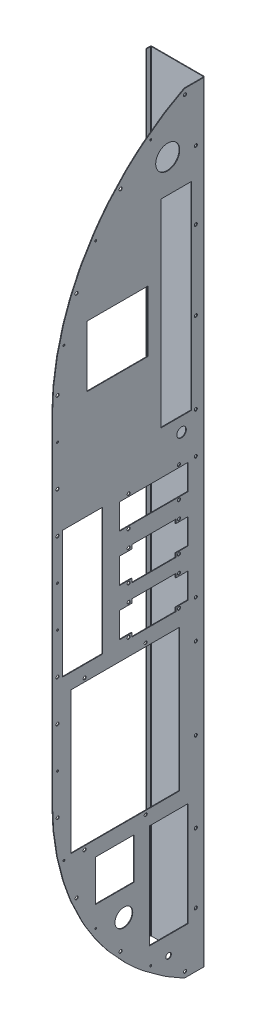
SolidWorks part; units mm, degrees
ref_plane "Front Plane" through (0, 0, 0) normal (0, 0, 1) x (1, 0, 0)
ref_plane "Top Plane" through (0, 0, 0) normal (0, 1, 0) x (1, 0, 0)
ref_plane "Right Plane" through (0, 0, 0) normal (1, 0, 0) x (0, 0, -1)
imported_body "Imported3"
sketch "Sketch1" plane through (0, 0, 767.8712) normal (0, 0, 1) x (1, 0, 0)
  line L0 (840.893, 1048.4829) -> (840.893, 86.5849)
  line L1 (840.893, 86.5849) -> (840.0993, 86.5849)
  line L2 (840.0993, 86.5849) -> (840.0993, 1048.4829)
  line L3 (840.0993, 1048.4829) -> (840.893, 1048.4829)
extrude "Boss-Extrude1" add sketch "Sketch1" along normal blind 4.7435
sketch "Sketch2" plane through (906.7425, 0, 0) normal (-1, 0, 0) x (0, 0, 1)
  line L0 (872.7296, 979.9071) -> (872.6759, 980.1076)
  line L1 (872.6759, 980.1076) -> (872.5882, 980.2957)
  line L2 (872.5882, 980.2957) -> (872.4691, 980.4657)
  line L3 (872.4691, 980.4657) -> (872.3224, 980.6124)
  line L4 (872.3224, 980.6124) -> (872.1523, 980.7315)
  line L5 (872.1523, 980.7315) -> (871.9643, 980.8192)
  line L6 (871.9643, 980.8192) -> (871.7638, 980.8729)
  line L7 (871.7638, 980.8729) -> (871.5571, 980.891)
  line L8 (871.5571, 980.891) -> (871.3503, 980.8729)
  line L9 (871.3503, 980.8729) -> (871.1498, 980.8192)
  line L10 (871.1498, 980.8192) -> (870.9617, 980.7315)
  line L11 (870.9617, 980.7315) -> (870.7917, 980.6124)
  line L12 (870.7917, 980.6124) -> (870.645, 980.4657)
  line L13 (870.645, 980.4657) -> (870.526, 980.2957)
  line L14 (870.526, 980.2957) -> (870.4382, 980.1076)
  line L15 (870.4382, 980.1076) -> (870.3845, 979.9071)
  line L16 (870.3845, 979.9071) -> (870.3665, 979.7004)
  line L17 (870.3665, 979.7004) -> (870.3845, 979.4937)
  line L18 (870.3845, 979.4937) -> (870.4382, 979.2932)
  line L19 (870.4382, 979.2932) -> (870.526, 979.1051)
  line L20 (870.526, 979.1051) -> (870.645, 978.9351)
  line L21 (870.645, 978.9351) -> (870.7917, 978.7883)
  line L22 (870.7917, 978.7883) -> (870.9617, 978.6693)
  line L23 (870.9617, 978.6693) -> (871.1498, 978.5816)
  line L24 (871.1498, 978.5816) -> (871.3503, 978.5278)
  line L25 (871.3503, 978.5278) -> (871.5571, 978.5098)
  line L26 (871.5571, 978.5098) -> (871.7638, 978.5278)
  line L27 (871.7638, 978.5278) -> (871.9643, 978.5816)
  line L28 (871.9643, 978.5816) -> (872.1523, 978.6693)
  line L29 (872.1523, 978.6693) -> (872.3224, 978.7883)
  line L30 (872.3224, 978.7883) -> (872.4691, 978.9351)
  line L31 (872.4691, 978.9351) -> (872.5882, 979.1051)
  line L32 (872.5882, 979.1051) -> (872.6759, 979.2932)
  line L33 (872.6759, 979.2932) -> (872.7296, 979.4937)
  line L34 (872.7296, 979.4937) -> (872.7477, 979.7004)
  line L35 (872.7477, 979.7004) -> (872.7296, 979.9071)
extrude "Cut-Extrude1" cut sketch "Sketch2" against normal through all
sketch "Sketch3" plane through (906.7425, 0, 0) normal (-1, 0, 0) x (0, 0, 1)
  line L0 (790.2309, 94.2395) -> (790.1118, 94.0695)
  line L1 (790.1118, 94.0695) -> (790.0241, 93.8814)
  line L2 (790.0241, 93.8814) -> (789.9704, 93.6809)
  line L3 (789.9704, 93.6809) -> (789.9523, 93.4741)
  line L4 (789.9523, 93.4741) -> (789.9704, 93.2674)
  line L5 (789.9704, 93.2674) -> (790.0241, 93.0669)
  line L6 (790.0241, 93.0669) -> (790.1118, 92.8788)
  line L7 (790.1118, 92.8788) -> (790.2309, 92.7089)
  line L8 (790.2309, 92.7089) -> (790.3776, 92.5621)
  line L9 (790.3776, 92.5621) -> (790.5476, 92.443)
  line L10 (790.5476, 92.443) -> (790.7357, 92.3553)
  line L11 (790.7357, 92.3553) -> (790.9362, 92.3016)
  line L12 (790.9362, 92.3016) -> (791.1429, 92.2835)
  line L13 (791.1429, 92.2835) -> (791.3496, 92.3016)
  line L14 (791.3496, 92.3016) -> (791.5502, 92.3553)
  line L15 (791.5502, 92.3553) -> (791.7383, 92.443)
  line L16 (791.7383, 92.443) -> (791.9083, 92.5621)
  line L17 (791.9083, 92.5621) -> (792.055, 92.7089)
  line L18 (792.055, 92.7089) -> (792.1741, 92.8788)
  line L19 (792.1741, 92.8788) -> (792.2618, 93.0669)
  line L20 (792.2618, 93.0669) -> (792.3155, 93.2674)
  line L21 (792.3155, 93.2674) -> (792.3335, 93.4741)
  line L22 (792.3335, 93.4741) -> (792.3155, 93.6809)
  line L23 (792.3155, 93.6809) -> (792.2618, 93.8814)
  line L24 (792.2618, 93.8814) -> (792.1741, 94.0695)
  line L25 (792.1741, 94.0695) -> (792.055, 94.2395)
  line L26 (792.055, 94.2395) -> (791.9083, 94.3862)
  line L27 (791.9083, 94.3862) -> (791.7383, 94.5053)
  line L28 (791.7383, 94.5053) -> (791.5502, 94.593)
  line L29 (791.5502, 94.593) -> (791.3496, 94.6467)
  line L30 (791.3496, 94.6467) -> (791.1429, 94.6648)
  line L31 (791.1429, 94.6648) -> (790.9362, 94.6467)
  line L32 (790.9362, 94.6467) -> (790.7357, 94.593)
  line L33 (790.7357, 94.593) -> (790.5476, 94.5053)
  line L34 (790.5476, 94.5053) -> (790.3776, 94.3862)
  line L35 (790.3776, 94.3862) -> (790.2309, 94.2395)
  circle A0 centre (791.143, 93.4742) radius 1.1906
extrude "Cut-Extrude2" cut sketch "Sketch3" against normal through all contours L35 L0 L1 L2 L3 L4 L5 L6 L7 L8 L9 L10 L11 L12 L13 L14 L15 L16 L17 L18 L19 L20 L21 L22 L23 L24 L25 L26 L27 L28 L29 L30 L31 L32 L33 L34
sketch "Sketch4" plane through (906.7425, 0, 0) normal (-1, 0, 0) x (0, 0, 1)
  line L0 (835.1724, 1014.2965) -> (835.1187, 1014.497)
  line L1 (835.1187, 1014.497) -> (835.0309, 1014.685)
  line L2 (835.0309, 1014.685) -> (834.9119, 1014.8551)
  line L3 (834.9119, 1014.8551) -> (834.7651, 1015.0018)
  line L4 (834.7651, 1015.0018) -> (834.5951, 1015.1209)
  line L5 (834.5951, 1015.1209) -> (834.407, 1015.2086)
  line L6 (834.407, 1015.2086) -> (834.2065, 1015.2622)
  line L7 (834.2065, 1015.2622) -> (833.9998, 1015.2804)
  line L8 (833.9998, 1015.2804) -> (833.793, 1015.2622)
  line L9 (833.793, 1015.2622) -> (833.5926, 1015.2086)
  line L10 (833.5926, 1015.2086) -> (833.4045, 1015.1209)
  line L11 (833.4045, 1015.1209) -> (833.2345, 1015.0018)
  line L12 (833.2345, 1015.0018) -> (833.0877, 1014.8551)
  line L13 (833.0877, 1014.8551) -> (832.9687, 1014.685)
  line L14 (832.9687, 1014.685) -> (832.881, 1014.497)
  line L15 (832.881, 1014.497) -> (832.8273, 1014.2965)
  line L16 (832.8273, 1014.2965) -> (832.8092, 1014.0898)
  line L17 (832.8092, 1014.0898) -> (832.8273, 1013.883)
  line L18 (832.8273, 1013.883) -> (832.881, 1013.6826)
  line L19 (832.881, 1013.6826) -> (832.9687, 1013.4945)
  line L20 (832.9687, 1013.4945) -> (833.0877, 1013.3245)
  line L21 (833.0877, 1013.3245) -> (833.2345, 1013.1776)
  line L22 (833.2345, 1013.1776) -> (833.4045, 1013.0587)
  line L23 (833.4045, 1013.0587) -> (833.5926, 1012.9709)
  line L24 (833.5926, 1012.9709) -> (833.793, 1012.9173)
  line L25 (833.793, 1012.9173) -> (833.9998, 1012.8992)
  line L26 (833.9998, 1012.8992) -> (834.2065, 1012.9173)
  line L27 (834.2065, 1012.9173) -> (834.407, 1012.9709)
  line L28 (834.407, 1012.9709) -> (834.5951, 1013.0587)
  line L29 (834.5951, 1013.0587) -> (834.7651, 1013.1776)
  line L30 (834.7651, 1013.1776) -> (834.9119, 1013.3245)
  line L31 (834.9119, 1013.3245) -> (835.0309, 1013.4945)
  line L32 (835.0309, 1013.4945) -> (835.1187, 1013.6826)
  line L33 (835.1187, 1013.6826) -> (835.1724, 1013.883)
  line L34 (835.1724, 1013.883) -> (835.1904, 1014.0898)
  line L35 (835.1904, 1014.0898) -> (835.1724, 1014.2965)
extrude "Cut-Extrude3" cut sketch "Sketch4" against normal through all
sketch "Sketch5" plane through (906.7425, 0, 0) normal (-1, 0, 0) x (0, 0, 1)
  line L0 (833.5926, 119.8592) -> (833.793, 119.8055)
  line L1 (833.793, 119.8055) -> (833.9998, 119.7875)
  line L2 (833.9998, 119.7875) -> (834.2065, 119.8055)
  line L3 (834.2065, 119.8055) -> (834.407, 119.8592)
  line L4 (834.407, 119.8592) -> (834.5951, 119.947)
  line L5 (834.5951, 119.947) -> (834.7651, 120.066)
  line L6 (834.7651, 120.066) -> (834.9119, 120.2127)
  line L7 (834.9119, 120.2127) -> (835.0309, 120.3828)
  line L8 (835.0309, 120.3828) -> (835.1187, 120.5708)
  line L9 (835.1187, 120.5708) -> (835.1724, 120.7713)
  line L10 (835.1724, 120.7713) -> (835.1904, 120.9781)
  line L11 (835.1904, 120.9781) -> (835.1724, 121.1848)
  line L12 (835.1724, 121.1848) -> (835.1187, 121.3853)
  line L13 (835.1187, 121.3853) -> (835.0309, 121.5734)
  line L14 (835.0309, 121.5734) -> (834.9119, 121.7434)
  line L15 (834.9119, 121.7434) -> (834.7651, 121.8901)
  line L16 (834.7651, 121.8901) -> (834.5951, 122.0092)
  line L17 (834.5951, 122.0092) -> (834.407, 122.0969)
  line L18 (834.407, 122.0969) -> (834.2065, 122.1506)
  line L19 (834.2065, 122.1506) -> (833.9998, 122.1687)
  line L20 (833.9998, 122.1687) -> (833.793, 122.1506)
  line L21 (833.793, 122.1506) -> (833.5926, 122.0969)
  line L22 (833.5926, 122.0969) -> (833.4045, 122.0092)
  line L23 (833.4045, 122.0092) -> (833.2345, 121.8901)
  line L24 (833.2345, 121.8901) -> (833.0877, 121.7434)
  line L25 (833.0877, 121.7434) -> (832.9687, 121.5734)
  line L26 (832.9687, 121.5734) -> (832.881, 121.3853)
  line L27 (832.881, 121.3853) -> (832.8273, 121.1848)
  line L28 (832.8273, 121.1848) -> (832.8092, 120.9781)
  line L29 (832.8092, 120.9781) -> (832.8273, 120.7713)
  line L30 (832.8273, 120.7713) -> (832.881, 120.5708)
  line L31 (832.881, 120.5708) -> (832.9687, 120.3828)
  line L32 (832.9687, 120.3828) -> (833.0877, 120.2127)
  line L33 (833.0877, 120.2127) -> (833.2345, 120.066)
  line L34 (833.2345, 120.066) -> (833.4045, 119.947)
  line L35 (833.4045, 119.947) -> (833.5926, 119.8592)
extrude "Cut-Extrude4" cut sketch "Sketch5" against normal through all
sketch "Sketch6" plane through (906.7425, 0, 0) normal (-1, 0, 0) x (0, 0, 1)
  line L0 (950.0074, 746.4527) -> (949.8193, 746.3651)
  line L1 (949.8193, 746.3651) -> (949.6493, 746.246)
  line L2 (949.6493, 746.246) -> (949.5026, 746.0992)
  line L3 (949.5026, 746.0992) -> (949.3836, 745.9292)
  line L4 (949.3836, 745.9292) -> (949.2958, 745.7411)
  line L5 (949.2958, 745.7411) -> (949.2421, 745.5407)
  line L6 (949.2421, 745.5407) -> (949.2241, 745.3339)
  line L7 (949.2241, 745.3339) -> (949.2421, 745.1271)
  line L8 (949.2421, 745.1271) -> (949.2958, 744.9267)
  line L9 (949.2958, 744.9267) -> (949.3836, 744.7386)
  line L10 (949.3836, 744.7386) -> (949.5026, 744.5686)
  line L11 (949.5026, 744.5686) -> (949.6493, 744.4218)
  line L12 (949.6493, 744.4218) -> (949.8193, 744.3028)
  line L13 (949.8193, 744.3028) -> (950.0074, 744.2151)
  line L14 (950.0074, 744.2151) -> (950.2079, 744.1614)
  line L15 (950.2079, 744.1614) -> (950.4147, 744.1433)
  line L16 (950.4147, 744.1433) -> (950.6214, 744.1614)
  line L17 (950.6214, 744.1614) -> (950.8219, 744.2151)
  line L18 (950.8219, 744.2151) -> (951.0099, 744.3028)
  line L19 (951.0099, 744.3028) -> (951.18, 744.4218)
  line L20 (951.18, 744.4218) -> (951.3267, 744.5686)
  line L21 (951.3267, 744.5686) -> (951.4458, 744.7386)
  line L22 (951.4458, 744.7386) -> (951.5335, 744.9267)
  line L23 (951.5335, 744.9267) -> (951.5872, 745.1271)
  line L24 (951.5872, 745.1271) -> (951.6053, 745.3339)
  line L25 (951.6053, 745.3339) -> (951.5872, 745.5407)
  line L26 (951.5872, 745.5407) -> (951.5335, 745.7411)
  line L27 (951.5335, 745.7411) -> (951.4458, 745.9292)
  line L28 (951.4458, 745.9292) -> (951.3267, 746.0992)
  line L29 (951.3267, 746.0992) -> (951.18, 746.246)
  line L30 (951.18, 746.246) -> (951.0099, 746.3651)
  line L31 (951.0099, 746.3651) -> (950.8219, 746.4527)
  line L32 (950.8219, 746.4527) -> (950.6214, 746.5065)
  line L33 (950.6214, 746.5065) -> (950.4147, 746.5245)
  line L34 (950.4147, 746.5245) -> (950.2079, 746.5065)
  line L35 (950.2079, 746.5065) -> (950.0074, 746.4527)
extrude "Cut-Extrude5" cut sketch "Sketch6" against normal through all
sketch "Sketch7" plane through (906.7425, 0, 0) normal (-1, 0, 0) x (0, 0, 1)
  line L0 (872.5882, 154.7721) -> (872.6759, 154.9602)
  line L1 (872.6759, 154.9602) -> (872.7296, 155.1607)
  line L2 (872.7296, 155.1607) -> (872.7477, 155.3674)
  line L3 (872.7477, 155.3674) -> (872.7296, 155.5742)
  line L4 (872.7296, 155.5742) -> (872.6759, 155.7747)
  line L5 (872.6759, 155.7747) -> (872.5882, 155.9627)
  line L6 (872.5882, 155.9627) -> (872.4691, 156.1328)
  line L7 (872.4691, 156.1328) -> (872.3224, 156.2795)
  line L8 (872.3224, 156.2795) -> (872.1523, 156.3985)
  line L9 (872.1523, 156.3985) -> (871.9643, 156.4862)
  line L10 (871.9643, 156.4862) -> (871.7638, 156.54)
  line L11 (871.7638, 156.54) -> (871.5571, 156.5581)
  line L12 (871.5571, 156.5581) -> (871.3503, 156.54)
  line L13 (871.3503, 156.54) -> (871.1498, 156.4862)
  line L14 (871.1498, 156.4862) -> (870.9617, 156.3985)
  line L15 (870.9617, 156.3985) -> (870.7917, 156.2795)
  line L16 (870.7917, 156.2795) -> (870.645, 156.1328)
  line L17 (870.645, 156.1328) -> (870.526, 155.9627)
  line L18 (870.526, 155.9627) -> (870.4382, 155.7747)
  line L19 (870.4382, 155.7747) -> (870.3845, 155.5742)
  line L20 (870.3845, 155.5742) -> (870.3665, 155.3674)
  line L21 (870.3665, 155.3674) -> (870.3845, 155.1607)
  line L22 (870.3845, 155.1607) -> (870.4382, 154.9602)
  line L23 (870.4382, 154.9602) -> (870.526, 154.7721)
  line L24 (870.526, 154.7721) -> (870.645, 154.6021)
  line L25 (870.645, 154.6021) -> (870.7917, 154.4554)
  line L26 (870.7917, 154.4554) -> (870.9617, 154.3363)
  line L27 (870.9617, 154.3363) -> (871.1498, 154.2486)
  line L28 (871.1498, 154.2486) -> (871.3503, 154.1949)
  line L29 (871.3503, 154.1949) -> (871.5571, 154.1768)
  line L30 (871.5571, 154.1768) -> (871.7638, 154.1949)
  line L31 (871.7638, 154.1949) -> (871.9643, 154.2486)
  line L32 (871.9643, 154.2486) -> (872.1523, 154.3363)
  line L33 (872.1523, 154.3363) -> (872.3224, 154.4554)
  line L34 (872.3224, 154.4554) -> (872.4691, 154.6021)
  line L35 (872.4691, 154.6021) -> (872.5882, 154.7721)
extrude "Cut-Extrude6" cut sketch "Sketch7" against normal through all
sketch "Sketch8" plane through (906.7425, 0, 0) normal (-1, 0, 0) x (0, 0, 1)
  line L0 (927.7577, 894.6481) -> (927.704, 894.8485)
  line L1 (927.704, 894.8485) -> (927.6164, 895.0366)
  line L2 (927.6164, 895.0366) -> (927.4973, 895.2066)
  line L3 (927.4973, 895.2066) -> (927.3505, 895.3534)
  line L4 (927.3505, 895.3534) -> (927.1805, 895.4724)
  line L5 (927.1805, 895.4724) -> (926.9924, 895.5601)
  line L6 (926.9924, 895.5601) -> (926.792, 895.6138)
  line L7 (926.792, 895.6138) -> (926.5852, 895.632)
  line L8 (926.5852, 895.632) -> (926.3785, 895.6138)
  line L9 (926.3785, 895.6138) -> (926.178, 895.5601)
  line L10 (926.178, 895.5601) -> (925.9899, 895.4724)
  line L11 (925.9899, 895.4724) -> (925.8199, 895.3534)
  line L12 (925.8199, 895.3534) -> (925.6731, 895.2066)
  line L13 (925.6731, 895.2066) -> (925.5542, 895.0366)
  line L14 (925.5542, 895.0366) -> (925.4664, 894.8485)
  line L15 (925.4664, 894.8485) -> (925.4127, 894.6481)
  line L16 (925.4127, 894.6481) -> (925.3946, 894.4413)
  line L17 (925.3946, 894.4413) -> (925.4127, 894.2345)
  line L18 (925.4127, 894.2345) -> (925.4664, 894.034)
  line L19 (925.4664, 894.034) -> (925.5542, 893.846)
  line L20 (925.5542, 893.846) -> (925.6731, 893.676)
  line L21 (925.6731, 893.676) -> (925.8199, 893.5292)
  line L22 (925.8199, 893.5292) -> (925.9899, 893.4102)
  line L23 (925.9899, 893.4102) -> (926.178, 893.3225)
  line L24 (926.178, 893.3225) -> (926.3785, 893.2688)
  line L25 (926.3785, 893.2688) -> (926.5852, 893.2507)
  line L26 (926.5852, 893.2507) -> (926.792, 893.2688)
  line L27 (926.792, 893.2688) -> (926.9924, 893.3225)
  line L28 (926.9924, 893.3225) -> (927.1805, 893.4102)
  line L29 (927.1805, 893.4102) -> (927.3505, 893.5292)
  line L30 (927.3505, 893.5292) -> (927.4973, 893.676)
  line L31 (927.4973, 893.676) -> (927.6164, 893.846)
  line L32 (927.6164, 893.846) -> (927.704, 894.034)
  line L33 (927.704, 894.034) -> (927.7577, 894.2345)
  line L34 (927.7577, 894.2345) -> (927.7758, 894.4413)
  line L35 (927.7758, 894.4413) -> (927.7577, 894.6481)
extrude "Cut-Extrude7" cut sketch "Sketch8" against normal through all
sketch "Sketch9" plane through (906.7425, 0, 0) normal (-1, 0, 0) x (0, 0, 1)
  line L0 (903.7524, 938.8314) -> (903.8401, 939.0196)
  line L1 (903.8401, 939.0196) -> (903.8938, 939.22)
  line L2 (903.8938, 939.22) -> (903.9119, 939.4268)
  line L3 (903.9119, 939.4268) -> (903.8938, 939.6335)
  line L4 (903.8938, 939.6335) -> (903.8401, 939.834)
  line L5 (903.8401, 939.834) -> (903.7524, 940.0221)
  line L6 (903.7524, 940.0221) -> (903.6334, 940.1921)
  line L7 (903.6334, 940.1921) -> (903.4866, 940.3388)
  line L8 (903.4866, 940.3388) -> (903.3166, 940.4578)
  line L9 (903.3166, 940.4578) -> (903.1285, 940.5456)
  line L10 (903.1285, 940.5456) -> (902.9281, 940.5993)
  line L11 (902.9281, 940.5993) -> (902.7213, 940.6174)
  line L12 (902.7213, 940.6174) -> (902.5145, 940.5993)
  line L13 (902.5145, 940.5993) -> (902.3141, 940.5456)
  line L14 (902.3141, 940.5456) -> (902.126, 940.4578)
  line L15 (902.126, 940.4578) -> (901.956, 940.3388)
  line L16 (901.956, 940.3388) -> (901.8092, 940.1921)
  line L17 (901.8092, 940.1921) -> (901.6902, 940.0221)
  line L18 (901.6902, 940.0221) -> (901.6025, 939.834)
  line L19 (901.6025, 939.834) -> (901.5487, 939.6335)
  line L20 (901.5487, 939.6335) -> (901.5306, 939.4268)
  line L21 (901.5306, 939.4268) -> (901.5487, 939.22)
  line L22 (901.5487, 939.22) -> (901.6025, 939.0196)
  line L23 (901.6025, 939.0196) -> (901.6902, 938.8314)
  line L24 (901.6902, 938.8314) -> (901.8092, 938.6615)
  line L25 (901.8092, 938.6615) -> (901.956, 938.5147)
  line L26 (901.956, 938.5147) -> (902.126, 938.3956)
  line L27 (902.126, 938.3956) -> (902.3141, 938.3079)
  line L28 (902.3141, 938.3079) -> (902.5145, 938.2542)
  line L29 (902.5145, 938.2542) -> (902.7213, 938.2361)
  line L30 (902.7213, 938.2361) -> (902.9281, 938.2542)
  line L31 (902.9281, 938.2542) -> (903.1285, 938.3079)
  line L32 (903.1285, 938.3079) -> (903.3166, 938.3956)
  line L33 (903.3166, 938.3956) -> (903.4866, 938.5147)
  line L34 (903.4866, 938.5147) -> (903.6334, 938.6615)
  line L35 (903.6334, 938.6615) -> (903.7524, 938.8314)
extrude "Cut-Extrude8" cut sketch "Sketch9" against normal through all
sketch "Sketch10" plane through (906.7425, 0, 0) normal (-1, 0, 0) x (0, 0, 1)
  line L0 (950.0074, 492.4527) -> (949.8193, 492.365)
  line L1 (949.8193, 492.365) -> (949.6493, 492.246)
  line L2 (949.6493, 492.246) -> (949.5026, 492.0993)
  line L3 (949.5026, 492.0993) -> (949.3836, 491.9292)
  line L4 (949.3836, 491.9292) -> (949.2958, 491.7411)
  line L5 (949.2958, 491.7411) -> (949.2421, 491.5406)
  line L6 (949.2421, 491.5406) -> (949.2241, 491.3339)
  line L7 (949.2241, 491.3339) -> (949.2421, 491.1272)
  line L8 (949.2421, 491.1272) -> (949.2958, 490.9267)
  line L9 (949.2958, 490.9267) -> (949.3836, 490.7386)
  line L10 (949.3836, 490.7386) -> (949.5026, 490.5686)
  line L11 (949.5026, 490.5686) -> (949.6493, 490.4218)
  line L12 (949.6493, 490.4218) -> (949.8193, 490.3028)
  line L13 (949.8193, 490.3028) -> (950.0074, 490.2151)
  line L14 (950.0074, 490.2151) -> (950.2079, 490.1614)
  line L15 (950.2079, 490.1614) -> (950.4147, 490.1433)
  line L16 (950.4147, 490.1433) -> (950.6214, 490.1614)
  line L17 (950.6214, 490.1614) -> (950.8219, 490.2151)
  line L18 (950.8219, 490.2151) -> (951.0099, 490.3028)
  line L19 (951.0099, 490.3028) -> (951.18, 490.4218)
  line L20 (951.18, 490.4218) -> (951.3267, 490.5686)
  line L21 (951.3267, 490.5686) -> (951.4458, 490.7386)
  line L22 (951.4458, 490.7386) -> (951.5335, 490.9267)
  line L23 (951.5335, 490.9267) -> (951.5872, 491.1272)
  line L24 (951.5872, 491.1272) -> (951.6053, 491.3339)
  line L25 (951.6053, 491.3339) -> (951.5872, 491.5406)
  line L26 (951.5872, 491.5406) -> (951.5335, 491.7411)
  line L27 (951.5335, 491.7411) -> (951.4458, 491.9292)
  line L28 (951.4458, 491.9292) -> (951.3267, 492.0993)
  line L29 (951.3267, 492.0993) -> (951.18, 492.246)
  line L30 (951.18, 492.246) -> (951.0099, 492.365)
  line L31 (951.0099, 492.365) -> (950.8219, 492.4527)
  line L32 (950.8219, 492.4527) -> (950.6214, 492.5064)
  line L33 (950.6214, 492.5064) -> (950.4147, 492.5245)
  line L34 (950.4147, 492.5245) -> (950.2079, 492.5064)
  line L35 (950.2079, 492.5064) -> (950.0074, 492.4527)
extrude "Cut-Extrude9" cut sketch "Sketch10" against normal through all
sketch "Sketch11" plane through (906.7425, 0, 0) normal (-1, 0, 0) x (0, 0, 1)
  line L0 (790.3776, 1042.5057) -> (790.2309, 1042.359)
  line L1 (790.2309, 1042.359) -> (790.1118, 1042.189)
  line L2 (790.1118, 1042.189) -> (790.0241, 1042.0009)
  line L3 (790.0241, 1042.0009) -> (789.9704, 1041.8004)
  line L4 (789.9704, 1041.8004) -> (789.9523, 1041.5937)
  line L5 (789.9523, 1041.5937) -> (789.9704, 1041.387)
  line L6 (789.9704, 1041.387) -> (790.0241, 1041.1865)
  line L7 (790.0241, 1041.1865) -> (790.1118, 1040.9983)
  line L8 (790.1118, 1040.9983) -> (790.2309, 1040.8283)
  line L9 (790.2309, 1040.8283) -> (790.3776, 1040.6816)
  line L10 (790.3776, 1040.6816) -> (790.5476, 1040.5625)
  line L11 (790.5476, 1040.5625) -> (790.7357, 1040.4749)
  line L12 (790.7357, 1040.4749) -> (790.9362, 1040.4211)
  line L13 (790.9362, 1040.4211) -> (791.1429, 1040.4031)
  line L14 (791.1429, 1040.4031) -> (791.3496, 1040.4211)
  line L15 (791.3496, 1040.4211) -> (791.5502, 1040.4749)
  line L16 (791.5502, 1040.4749) -> (791.7383, 1040.5625)
  line L17 (791.7383, 1040.5625) -> (791.9083, 1040.6816)
  line L18 (791.9083, 1040.6816) -> (792.055, 1040.8283)
  line L19 (792.055, 1040.8283) -> (792.1741, 1040.9983)
  line L20 (792.1741, 1040.9983) -> (792.2618, 1041.1865)
  line L21 (792.2618, 1041.1865) -> (792.3155, 1041.387)
  line L22 (792.3155, 1041.387) -> (792.3335, 1041.5937)
  line L23 (792.3335, 1041.5937) -> (792.3155, 1041.8004)
  line L24 (792.3155, 1041.8004) -> (792.2618, 1042.0009)
  line L25 (792.2618, 1042.0009) -> (792.1741, 1042.189)
  line L26 (792.1741, 1042.189) -> (792.055, 1042.359)
  line L27 (792.055, 1042.359) -> (791.9083, 1042.5057)
  line L28 (791.9083, 1042.5057) -> (791.7383, 1042.6247)
  line L29 (791.7383, 1042.6247) -> (791.5502, 1042.7126)
  line L30 (791.5502, 1042.7126) -> (791.3496, 1042.7662)
  line L31 (791.3496, 1042.7662) -> (791.1429, 1042.7843)
  line L32 (791.1429, 1042.7843) -> (790.9362, 1042.7662)
  line L33 (790.9362, 1042.7662) -> (790.7357, 1042.7126)
  line L34 (790.7357, 1042.7126) -> (790.5476, 1042.6247)
  line L35 (790.5476, 1042.6247) -> (790.3776, 1042.5057)
extrude "Cut-Extrude10" cut sketch "Sketch11" against normal through all
sketch "Sketch12" plane through (906.7425, 0, 0) normal (-1, 0, 0) x (0, 0, 1)
  line L0 (950.1864, 797.0831) -> (949.9797, 797.065)
  line L1 (949.9797, 797.065) -> (949.7792, 797.0113)
  line L2 (949.7792, 797.0113) -> (949.5911, 796.9236)
  line L3 (949.5911, 796.9236) -> (949.4211, 796.8045)
  line L4 (949.4211, 796.8045) -> (949.2744, 796.6578)
  line L5 (949.2744, 796.6578) -> (949.1553, 796.4878)
  line L6 (949.1553, 796.4878) -> (949.0677, 796.2997)
  line L7 (949.0677, 796.2997) -> (949.0139, 796.0992)
  line L8 (949.0139, 796.0992) -> (948.9958, 795.8925)
  line L9 (948.9958, 795.8925) -> (949.0139, 795.6857)
  line L10 (949.0139, 795.6857) -> (949.0677, 795.4853)
  line L11 (949.0677, 795.4853) -> (949.1553, 795.2971)
  line L12 (949.1553, 795.2971) -> (949.2744, 795.1272)
  line L13 (949.2744, 795.1272) -> (949.4211, 794.9804)
  line L14 (949.4211, 794.9804) -> (949.5911, 794.8613)
  line L15 (949.5911, 794.8613) -> (949.7792, 794.7736)
  line L16 (949.7792, 794.7736) -> (949.9797, 794.7199)
  line L17 (949.9797, 794.7199) -> (950.1864, 794.7018)
  line L18 (950.1864, 794.7018) -> (950.3932, 794.7199)
  line L19 (950.3932, 794.7199) -> (950.5937, 794.7736)
  line L20 (950.5937, 794.7736) -> (950.7818, 794.8613)
  line L21 (950.7818, 794.8613) -> (950.9518, 794.9804)
  line L22 (950.9518, 794.9804) -> (951.0985, 795.1272)
  line L23 (951.0985, 795.1272) -> (951.2175, 795.2971)
  line L24 (951.2175, 795.2971) -> (951.3052, 795.4853)
  line L25 (951.3052, 795.4853) -> (951.359, 795.6857)
  line L26 (951.359, 795.6857) -> (951.3771, 795.8925)
  line L27 (951.3771, 795.8925) -> (951.359, 796.0992)
  line L28 (951.359, 796.0992) -> (951.3052, 796.2997)
  line L29 (951.3052, 796.2997) -> (951.2175, 796.4878)
  line L30 (951.2175, 796.4878) -> (951.0985, 796.6578)
  line L31 (951.0985, 796.6578) -> (950.9518, 796.8045)
  line L32 (950.9518, 796.8045) -> (950.7818, 796.9236)
  line L33 (950.7818, 796.9236) -> (950.5937, 797.0113)
  line L34 (950.5937, 797.0113) -> (950.3932, 797.065)
  line L35 (950.3932, 797.065) -> (950.1864, 797.0831)
extrude "Cut-Extrude11" cut sketch "Sketch12" against normal through all
sketch "Sketch13" plane through (906.7425, 0, 0) normal (-1, 0, 0) x (0, 0, 1)
  line L0 (943.5901, 846.4452) -> (943.5024, 846.6333)
  line L1 (943.5024, 846.6333) -> (943.3833, 846.8033)
  line L2 (943.3833, 846.8033) -> (943.2366, 846.95)
  line L3 (943.2366, 846.95) -> (943.0666, 847.0691)
  line L4 (943.0666, 847.0691) -> (942.8785, 847.1568)
  line L5 (942.8785, 847.1568) -> (942.678, 847.2105)
  line L6 (942.678, 847.2105) -> (942.4713, 847.2286)
  line L7 (942.4713, 847.2286) -> (942.2645, 847.2105)
  line L8 (942.2645, 847.2105) -> (942.064, 847.1568)
  line L9 (942.064, 847.1568) -> (941.876, 847.0691)
  line L10 (941.876, 847.0691) -> (941.7059, 846.95)
  line L11 (941.7059, 846.95) -> (941.5592, 846.8033)
  line L12 (941.5592, 846.8033) -> (941.4401, 846.6333)
  line L13 (941.4401, 846.6333) -> (941.3524, 846.4452)
  line L14 (941.3524, 846.4452) -> (941.2988, 846.2448)
  line L15 (941.2988, 846.2448) -> (941.2807, 846.038)
  line L16 (941.2807, 846.038) -> (941.2988, 845.8312)
  line L17 (941.2988, 845.8312) -> (941.3524, 845.6308)
  line L18 (941.3524, 845.6308) -> (941.4401, 845.4427)
  line L19 (941.4401, 845.4427) -> (941.5592, 845.2727)
  line L20 (941.5592, 845.2727) -> (941.7059, 845.1259)
  line L21 (941.7059, 845.1259) -> (941.876, 845.0068)
  line L22 (941.876, 845.0068) -> (942.064, 844.9191)
  line L23 (942.064, 844.9191) -> (942.2645, 844.8654)
  line L24 (942.2645, 844.8654) -> (942.4713, 844.8473)
  line L25 (942.4713, 844.8473) -> (942.678, 844.8654)
  line L26 (942.678, 844.8654) -> (942.8785, 844.9191)
  line L27 (942.8785, 844.9191) -> (943.0666, 845.0068)
  line L28 (943.0666, 845.0068) -> (943.2366, 845.1259)
  line L29 (943.2366, 845.1259) -> (943.3833, 845.2727)
  line L30 (943.3833, 845.2727) -> (943.5024, 845.4427)
  line L31 (943.5024, 845.4427) -> (943.5901, 845.6308)
  line L32 (943.5901, 845.6308) -> (943.6438, 845.8312)
  line L33 (943.6438, 845.8312) -> (943.6619, 846.038)
  line L34 (943.6619, 846.038) -> (943.6438, 846.2448)
  line L35 (943.6438, 846.2448) -> (943.5901, 846.4452)
extrude "Cut-Extrude12" cut sketch "Sketch13" against normal through all
sketch "Sketch14" plane through (906.7425, 0, 0) normal (-1, 0, 0) x (0, 0, 1)
  line L0 (950.0074, 644.8527) -> (949.8193, 644.765)
  line L1 (949.8193, 644.765) -> (949.6493, 644.646)
  line L2 (949.6493, 644.646) -> (949.5026, 644.4992)
  line L3 (949.5026, 644.4992) -> (949.3836, 644.3292)
  line L4 (949.3836, 644.3292) -> (949.2958, 644.1411)
  line L5 (949.2958, 644.1411) -> (949.2421, 643.9407)
  line L6 (949.2421, 643.9407) -> (949.2241, 643.7339)
  line L7 (949.2241, 643.7339) -> (949.2421, 643.5272)
  line L8 (949.2421, 643.5272) -> (949.2958, 643.3267)
  line L9 (949.2958, 643.3267) -> (949.3836, 643.1386)
  line L10 (949.3836, 643.1386) -> (949.5026, 642.9686)
  line L11 (949.5026, 642.9686) -> (949.6493, 642.8218)
  line L12 (949.6493, 642.8218) -> (949.8193, 642.7028)
  line L13 (949.8193, 642.7028) -> (950.0074, 642.6151)
  line L14 (950.0074, 642.6151) -> (950.2079, 642.5614)
  line L15 (950.2079, 642.5614) -> (950.4147, 642.5433)
  line L16 (950.4147, 642.5433) -> (950.6214, 642.5614)
  line L17 (950.6214, 642.5614) -> (950.8219, 642.6151)
  line L18 (950.8219, 642.6151) -> (951.0099, 642.7028)
  line L19 (951.0099, 642.7028) -> (951.18, 642.8218)
  line L20 (951.18, 642.8218) -> (951.3267, 642.9686)
  line L21 (951.3267, 642.9686) -> (951.4458, 643.1386)
  line L22 (951.4458, 643.1386) -> (951.5335, 643.3267)
  line L23 (951.5335, 643.3267) -> (951.5872, 643.5272)
  line L24 (951.5872, 643.5272) -> (951.6053, 643.7339)
  line L25 (951.6053, 643.7339) -> (951.5872, 643.9407)
  line L26 (951.5872, 643.9407) -> (951.5335, 644.1411)
  line L27 (951.5335, 644.1411) -> (951.4458, 644.3292)
  line L28 (951.4458, 644.3292) -> (951.3267, 644.4992)
  line L29 (951.3267, 644.4992) -> (951.18, 644.646)
  line L30 (951.18, 644.646) -> (951.0099, 644.765)
  line L31 (951.0099, 644.765) -> (950.8219, 644.8527)
  line L32 (950.8219, 644.8527) -> (950.6214, 644.9065)
  line L33 (950.6214, 644.9065) -> (950.4147, 644.9246)
  line L34 (950.4147, 644.9246) -> (950.2079, 644.9065)
  line L35 (950.2079, 644.9065) -> (950.0074, 644.8527)
extrude "Cut-Extrude13" cut sketch "Sketch14" against normal through all
sketch "Sketch15" plane through (906.7425, 0, 0) normal (-1, 0, 0) x (0, 0, 1)
  line L0 (951.5335, 593.3411) -> (951.4458, 593.5292)
  line L1 (951.4458, 593.5292) -> (951.3267, 593.6992)
  line L2 (951.3267, 593.6992) -> (951.18, 593.846)
  line L3 (951.18, 593.846) -> (951.0099, 593.9651)
  line L4 (951.0099, 593.9651) -> (950.8219, 594.0527)
  line L5 (950.8219, 594.0527) -> (950.6214, 594.1064)
  line L6 (950.6214, 594.1064) -> (950.4147, 594.1245)
  line L7 (950.4147, 594.1245) -> (950.2079, 594.1064)
  line L8 (950.2079, 594.1064) -> (950.0074, 594.0527)
  line L9 (950.0074, 594.0527) -> (949.8193, 593.9651)
  line L10 (949.8193, 593.9651) -> (949.6493, 593.846)
  line L11 (949.6493, 593.846) -> (949.5026, 593.6992)
  line L12 (949.5026, 593.6992) -> (949.3836, 593.5292)
  line L13 (949.3836, 593.5292) -> (949.2958, 593.3411)
  line L14 (949.2958, 593.3411) -> (949.2421, 593.1407)
  line L15 (949.2421, 593.1407) -> (949.2241, 592.9339)
  line L16 (949.2241, 592.9339) -> (949.2421, 592.7272)
  line L17 (949.2421, 592.7272) -> (949.2958, 592.5267)
  line L18 (949.2958, 592.5267) -> (949.3836, 592.3386)
  line L19 (949.3836, 592.3386) -> (949.5026, 592.1686)
  line L20 (949.5026, 592.1686) -> (949.6493, 592.0218)
  line L21 (949.6493, 592.0218) -> (949.8193, 591.9028)
  line L22 (949.8193, 591.9028) -> (950.0074, 591.8151)
  line L23 (950.0074, 591.8151) -> (950.2079, 591.7614)
  line L24 (950.2079, 591.7614) -> (950.4147, 591.7433)
  line L25 (950.4147, 591.7433) -> (950.6214, 591.7614)
  line L26 (950.6214, 591.7614) -> (950.8219, 591.8151)
  line L27 (950.8219, 591.8151) -> (951.0099, 591.9028)
  line L28 (951.0099, 591.9028) -> (951.18, 592.0218)
  line L29 (951.18, 592.0218) -> (951.3267, 592.1686)
  line L30 (951.3267, 592.1686) -> (951.4458, 592.3386)
  line L31 (951.4458, 592.3386) -> (951.5335, 592.5267)
  line L32 (951.5335, 592.5267) -> (951.5872, 592.7272)
  line L33 (951.5872, 592.7272) -> (951.6053, 592.9339)
  line L34 (951.6053, 592.9339) -> (951.5872, 593.1407)
  line L35 (951.5872, 593.1407) -> (951.5335, 593.3411)
extrude "Cut-Extrude14" cut sketch "Sketch15" against normal through all
sketch "Sketch16" plane through (906.7425, 0, 0) normal (-1, 0, 0) x (0, 0, 1)
  line L0 (951.18, 693.6218) -> (951.3267, 693.7686)
  line L1 (951.3267, 693.7686) -> (951.4458, 693.9386)
  line L2 (951.4458, 693.9386) -> (951.5335, 694.1267)
  line L3 (951.5335, 694.1267) -> (951.5872, 694.3272)
  line L4 (951.5872, 694.3272) -> (951.6053, 694.5339)
  line L5 (951.6053, 694.5339) -> (951.5872, 694.7407)
  line L6 (951.5872, 694.7407) -> (951.5335, 694.9412)
  line L7 (951.5335, 694.9412) -> (951.4458, 695.1292)
  line L8 (951.4458, 695.1292) -> (951.3267, 695.2992)
  line L9 (951.3267, 695.2992) -> (951.18, 695.446)
  line L10 (951.18, 695.446) -> (951.0099, 695.565)
  line L11 (951.0099, 695.565) -> (950.8219, 695.6527)
  line L12 (950.8219, 695.6527) -> (950.6214, 695.7064)
  line L13 (950.6214, 695.7064) -> (950.4147, 695.7245)
  line L14 (950.4147, 695.7245) -> (950.2079, 695.7064)
  line L15 (950.2079, 695.7064) -> (950.0074, 695.6527)
  line L16 (950.0074, 695.6527) -> (949.8193, 695.565)
  line L17 (949.8193, 695.565) -> (949.6493, 695.446)
  line L18 (949.6493, 695.446) -> (949.5026, 695.2992)
  line L19 (949.5026, 695.2992) -> (949.3836, 695.1292)
  line L20 (949.3836, 695.1292) -> (949.2958, 694.9412)
  line L21 (949.2958, 694.9412) -> (949.2421, 694.7407)
  line L22 (949.2421, 694.7407) -> (949.2241, 694.5339)
  line L23 (949.2241, 694.5339) -> (949.2421, 694.3272)
  line L24 (949.2421, 694.3272) -> (949.2958, 694.1267)
  line L25 (949.2958, 694.1267) -> (949.3836, 693.9386)
  line L26 (949.3836, 693.9386) -> (949.5026, 693.7686)
  line L27 (949.5026, 693.7686) -> (949.6493, 693.6218)
  line L28 (949.6493, 693.6218) -> (949.8193, 693.5028)
  line L29 (949.8193, 693.5028) -> (950.0074, 693.4151)
  line L30 (950.0074, 693.4151) -> (950.2079, 693.3614)
  line L31 (950.2079, 693.3614) -> (950.4147, 693.3433)
  line L32 (950.4147, 693.3433) -> (950.6214, 693.3614)
  line L33 (950.6214, 693.3614) -> (950.8219, 693.4151)
  line L34 (950.8219, 693.4151) -> (951.0099, 693.5028)
  line L35 (951.0099, 693.5028) -> (951.18, 693.6218)
extrude "Cut-Extrude15" cut sketch "Sketch16" against normal through all
sketch "Sketch17" plane through (906.7425, 0, 0) normal (-1, 0, 0) x (0, 0, 1)
  line L0 (902.7213, 194.4504) -> (902.9281, 194.4685)
  line L1 (902.9281, 194.4685) -> (903.1285, 194.5223)
  line L2 (903.1285, 194.5223) -> (903.3166, 194.61)
  line L3 (903.3166, 194.61) -> (903.4866, 194.729)
  line L4 (903.4866, 194.729) -> (903.6334, 194.8757)
  line L5 (903.6334, 194.8757) -> (903.7524, 195.0458)
  line L6 (903.7524, 195.0458) -> (903.8401, 195.2339)
  line L7 (903.8401, 195.2339) -> (903.8938, 195.4343)
  line L8 (903.8938, 195.4343) -> (903.9119, 195.6411)
  line L9 (903.9119, 195.6411) -> (903.8938, 195.8478)
  line L10 (903.8938, 195.8478) -> (903.8401, 196.0483)
  line L11 (903.8401, 196.0483) -> (903.7524, 196.2364)
  line L12 (903.7524, 196.2364) -> (903.6334, 196.4064)
  line L13 (903.6334, 196.4064) -> (903.4866, 196.5531)
  line L14 (903.4866, 196.5531) -> (903.3166, 196.6722)
  line L15 (903.3166, 196.6722) -> (903.1285, 196.7599)
  line L16 (903.1285, 196.7599) -> (902.9281, 196.8136)
  line L17 (902.9281, 196.8136) -> (902.7213, 196.8317)
  line L18 (902.7213, 196.8317) -> (902.5145, 196.8136)
  line L19 (902.5145, 196.8136) -> (902.3141, 196.7599)
  line L20 (902.3141, 196.7599) -> (902.126, 196.6722)
  line L21 (902.126, 196.6722) -> (901.956, 196.5531)
  line L22 (901.956, 196.5531) -> (901.8092, 196.4064)
  line L23 (901.8092, 196.4064) -> (901.6902, 196.2364)
  line L24 (901.6902, 196.2364) -> (901.6025, 196.0483)
  line L25 (901.6025, 196.0483) -> (901.5487, 195.8478)
  line L26 (901.5487, 195.8478) -> (901.5306, 195.6411)
  line L27 (901.5306, 195.6411) -> (901.5487, 195.4343)
  line L28 (901.5487, 195.4343) -> (901.6025, 195.2339)
  line L29 (901.6025, 195.2339) -> (901.6902, 195.0458)
  line L30 (901.6902, 195.0458) -> (901.8092, 194.8757)
  line L31 (901.8092, 194.8757) -> (901.956, 194.729)
  line L32 (901.956, 194.729) -> (902.126, 194.61)
  line L33 (902.126, 194.61) -> (902.3141, 194.5223)
  line L34 (902.3141, 194.5223) -> (902.5145, 194.4685)
  line L35 (902.5145, 194.4685) -> (902.7213, 194.4504)
extrude "Cut-Extrude16" cut sketch "Sketch17" against normal through all
sketch "Sketch18" plane through (906.7425, 0, 0) normal (-1, 0, 0) x (0, 0, 1)
  line L0 (949.2958, 541.7267) -> (949.3836, 541.5386)
  line L1 (949.3836, 541.5386) -> (949.5026, 541.3686)
  line L2 (949.5026, 541.3686) -> (949.6493, 541.2219)
  line L3 (949.6493, 541.2219) -> (949.8193, 541.1028)
  line L4 (949.8193, 541.1028) -> (950.0074, 541.0151)
  line L5 (950.0074, 541.0151) -> (950.2079, 540.9614)
  line L6 (950.2079, 540.9614) -> (950.4147, 540.9433)
  line L7 (950.4147, 540.9433) -> (950.6214, 540.9614)
  line L8 (950.6214, 540.9614) -> (950.8219, 541.0151)
  line L9 (950.8219, 541.0151) -> (951.0099, 541.1028)
  line L10 (951.0099, 541.1028) -> (951.18, 541.2219)
  line L11 (951.18, 541.2219) -> (951.3267, 541.3686)
  line L12 (951.3267, 541.3686) -> (951.4458, 541.5386)
  line L13 (951.4458, 541.5386) -> (951.5335, 541.7267)
  line L14 (951.5335, 541.7267) -> (951.5872, 541.9272)
  line L15 (951.5872, 541.9272) -> (951.6053, 542.1339)
  line L16 (951.6053, 542.1339) -> (951.5872, 542.3406)
  line L17 (951.5872, 542.3406) -> (951.5335, 542.5411)
  line L18 (951.5335, 542.5411) -> (951.4458, 542.7293)
  line L19 (951.4458, 542.7293) -> (951.3267, 542.8993)
  line L20 (951.3267, 542.8993) -> (951.18, 543.0459)
  line L21 (951.18, 543.0459) -> (951.0099, 543.165)
  line L22 (951.0099, 543.165) -> (950.8219, 543.2528)
  line L23 (950.8219, 543.2528) -> (950.6214, 543.3065)
  line L24 (950.6214, 543.3065) -> (950.4147, 543.3245)
  line L25 (950.4147, 543.3245) -> (950.2079, 543.3065)
  line L26 (950.2079, 543.3065) -> (950.0074, 543.2528)
  line L27 (950.0074, 543.2528) -> (949.8193, 543.165)
  line L28 (949.8193, 543.165) -> (949.6493, 543.0459)
  line L29 (949.6493, 543.0459) -> (949.5026, 542.8993)
  line L30 (949.5026, 542.8993) -> (949.3836, 542.7293)
  line L31 (949.3836, 542.7293) -> (949.2958, 542.5411)
  line L32 (949.2958, 542.5411) -> (949.2421, 542.3406)
  line L33 (949.2421, 542.3406) -> (949.2241, 542.1339)
  line L34 (949.2241, 542.1339) -> (949.2421, 541.9272)
  line L35 (949.2421, 541.9272) -> (949.2958, 541.7267)
extrude "Cut-Extrude17" cut sketch "Sketch18" against normal through all
sketch "Sketch19" plane through (906.7425, 0, 0) normal (-1, 0, 0) x (0, 0, 1)
  line L0 (951.3267, 441.2992) -> (951.18, 441.446)
  line L1 (951.18, 441.446) -> (951.0099, 441.565)
  line L2 (951.0099, 441.565) -> (950.8219, 441.6527)
  line L3 (950.8219, 441.6527) -> (950.6214, 441.7064)
  line L4 (950.6214, 441.7064) -> (950.4147, 441.7245)
  line L5 (950.4147, 441.7245) -> (950.2079, 441.7064)
  line L6 (950.2079, 441.7064) -> (950.0074, 441.6527)
  line L7 (950.0074, 441.6527) -> (949.8193, 441.565)
  line L8 (949.8193, 441.565) -> (949.6493, 441.446)
  line L9 (949.6493, 441.446) -> (949.5026, 441.2992)
  line L10 (949.5026, 441.2992) -> (949.3836, 441.1292)
  line L11 (949.3836, 441.1292) -> (949.2958, 440.9411)
  line L12 (949.2958, 440.9411) -> (949.2421, 440.7407)
  line L13 (949.2421, 440.7407) -> (949.2241, 440.5339)
  line L14 (949.2241, 440.5339) -> (949.2421, 440.3271)
  line L15 (949.2421, 440.3271) -> (949.2958, 440.1267)
  line L16 (949.2958, 440.1267) -> (949.3836, 439.9386)
  line L17 (949.3836, 439.9386) -> (949.5026, 439.7686)
  line L18 (949.5026, 439.7686) -> (949.6493, 439.6218)
  line L19 (949.6493, 439.6218) -> (949.8193, 439.5028)
  line L20 (949.8193, 439.5028) -> (950.0074, 439.4151)
  line L21 (950.0074, 439.4151) -> (950.2079, 439.3614)
  line L22 (950.2079, 439.3614) -> (950.4147, 439.3433)
  line L23 (950.4147, 439.3433) -> (950.6214, 439.3614)
  line L24 (950.6214, 439.3614) -> (950.8219, 439.4151)
  line L25 (950.8219, 439.4151) -> (951.0099, 439.5028)
  line L26 (951.0099, 439.5028) -> (951.18, 439.6218)
  line L27 (951.18, 439.6218) -> (951.3267, 439.7686)
  line L28 (951.3267, 439.7686) -> (951.4458, 439.9386)
  line L29 (951.4458, 439.9386) -> (951.5335, 440.1267)
  line L30 (951.5335, 440.1267) -> (951.5872, 440.3271)
  line L31 (951.5872, 440.3271) -> (951.6053, 440.5339)
  line L32 (951.6053, 440.5339) -> (951.5872, 440.7407)
  line L33 (951.5872, 440.7407) -> (951.5335, 440.9411)
  line L34 (951.5335, 440.9411) -> (951.4458, 441.1292)
  line L35 (951.4458, 441.1292) -> (951.3267, 441.2992)
extrude "Cut-Extrude18" cut sketch "Sketch19" against normal through all
sketch "Sketch20" plane through (906.7425, 0, 0) normal (-1, 0, 0) x (0, 0, 1)
  line L0 (925.4664, 240.2193) -> (925.5542, 240.0312)
  line L1 (925.5542, 240.0312) -> (925.6731, 239.8612)
  line L2 (925.6731, 239.8612) -> (925.8199, 239.7144)
  line L3 (925.8199, 239.7144) -> (925.9899, 239.5954)
  line L4 (925.9899, 239.5954) -> (926.178, 239.5077)
  line L5 (926.178, 239.5077) -> (926.3785, 239.454)
  line L6 (926.3785, 239.454) -> (926.5852, 239.4359)
  line L7 (926.5852, 239.4359) -> (926.792, 239.454)
  line L8 (926.792, 239.454) -> (926.9924, 239.5077)
  line L9 (926.9924, 239.5077) -> (927.1805, 239.5954)
  line L10 (927.1805, 239.5954) -> (927.3505, 239.7144)
  line L11 (927.3505, 239.7144) -> (927.4973, 239.8612)
  line L12 (927.4973, 239.8612) -> (927.6164, 240.0312)
  line L13 (927.6164, 240.0312) -> (927.704, 240.2193)
  line L14 (927.704, 240.2193) -> (927.7577, 240.4197)
  line L15 (927.7577, 240.4197) -> (927.7758, 240.6265)
  line L16 (927.7758, 240.6265) -> (927.7577, 240.8333)
  line L17 (927.7577, 240.8333) -> (927.704, 241.0337)
  line L18 (927.704, 241.0337) -> (927.6164, 241.2218)
  line L19 (927.6164, 241.2218) -> (927.4973, 241.3918)
  line L20 (927.4973, 241.3918) -> (927.3505, 241.5386)
  line L21 (927.3505, 241.5386) -> (927.1805, 241.6576)
  line L22 (927.1805, 241.6576) -> (926.9924, 241.7453)
  line L23 (926.9924, 241.7453) -> (926.792, 241.799)
  line L24 (926.792, 241.799) -> (926.5852, 241.8171)
  line L25 (926.5852, 241.8171) -> (926.3785, 241.799)
  line L26 (926.3785, 241.799) -> (926.178, 241.7453)
  line L27 (926.178, 241.7453) -> (925.9899, 241.6576)
  line L28 (925.9899, 241.6576) -> (925.8199, 241.5386)
  line L29 (925.8199, 241.5386) -> (925.6731, 241.3918)
  line L30 (925.6731, 241.3918) -> (925.5542, 241.2218)
  line L31 (925.5542, 241.2218) -> (925.4664, 241.0337)
  line L32 (925.4664, 241.0337) -> (925.4127, 240.8333)
  line L33 (925.4127, 240.8333) -> (925.3946, 240.6265)
  line L34 (925.3946, 240.6265) -> (925.4127, 240.4197)
  line L35 (925.4127, 240.4197) -> (925.4664, 240.2193)
extrude "Cut-Extrude19" cut sketch "Sketch20" against normal through all
sketch "Sketch21" plane through (906.7425, 0, 0) normal (-1, 0, 0) x (0, 0, 1)
  line L0 (943.6438, 289.2366) -> (943.5901, 289.4371)
  line L1 (943.5901, 289.4371) -> (943.5024, 289.6252)
  line L2 (943.5024, 289.6252) -> (943.3833, 289.7952)
  line L3 (943.3833, 289.7952) -> (943.2366, 289.9419)
  line L4 (943.2366, 289.9419) -> (943.0666, 290.061)
  line L5 (943.0666, 290.061) -> (942.8785, 290.1487)
  line L6 (942.8785, 290.1487) -> (942.678, 290.2024)
  line L7 (942.678, 290.2024) -> (942.4713, 290.2205)
  line L8 (942.4713, 290.2205) -> (942.2645, 290.2024)
  line L9 (942.2645, 290.2024) -> (942.064, 290.1487)
  line L10 (942.064, 290.1487) -> (941.876, 290.061)
  line L11 (941.876, 290.061) -> (941.7059, 289.9419)
  line L12 (941.7059, 289.9419) -> (941.5592, 289.7952)
  line L13 (941.5592, 289.7952) -> (941.4401, 289.6252)
  line L14 (941.4401, 289.6252) -> (941.3524, 289.4371)
  line L15 (941.3524, 289.4371) -> (941.2988, 289.2366)
  line L16 (941.2988, 289.2366) -> (941.2807, 289.0299)
  line L17 (941.2807, 289.0299) -> (941.2988, 288.8231)
  line L18 (941.2988, 288.8231) -> (941.3524, 288.6226)
  line L19 (941.3524, 288.6226) -> (941.4401, 288.4345)
  line L20 (941.4401, 288.4345) -> (941.5592, 288.2645)
  line L21 (941.5592, 288.2645) -> (941.7059, 288.1178)
  line L22 (941.7059, 288.1178) -> (941.876, 287.9987)
  line L23 (941.876, 287.9987) -> (942.064, 287.911)
  line L24 (942.064, 287.911) -> (942.2645, 287.8573)
  line L25 (942.2645, 287.8573) -> (942.4713, 287.8392)
  line L26 (942.4713, 287.8392) -> (942.678, 287.8573)
  line L27 (942.678, 287.8573) -> (942.8785, 287.911)
  line L28 (942.8785, 287.911) -> (943.0666, 287.9987)
  line L29 (943.0666, 287.9987) -> (943.2366, 288.1178)
  line L30 (943.2366, 288.1178) -> (943.3833, 288.2645)
  line L31 (943.3833, 288.2645) -> (943.5024, 288.4345)
  line L32 (943.5024, 288.4345) -> (943.5901, 288.6226)
  line L33 (943.5901, 288.6226) -> (943.6438, 288.8231)
  line L34 (943.6438, 288.8231) -> (943.6619, 289.0299)
  line L35 (943.6619, 289.0299) -> (943.6438, 289.2366)
extrude "Cut-Extrude20" cut sketch "Sketch21" against normal through all
sketch "Sketch22" plane through (906.7425, 0, 0) normal (-1, 0, 0) x (0, 0, 1)
  line L0 (950.0074, 390.8527) -> (949.8193, 390.765)
  line L1 (949.8193, 390.765) -> (949.6493, 390.646)
  line L2 (949.6493, 390.646) -> (949.5026, 390.4992)
  line L3 (949.5026, 390.4992) -> (949.3836, 390.3292)
  line L4 (949.3836, 390.3292) -> (949.2958, 390.1411)
  line L5 (949.2958, 390.1411) -> (949.2421, 389.9407)
  line L6 (949.2421, 389.9407) -> (949.2241, 389.7339)
  line L7 (949.2241, 389.7339) -> (949.2421, 389.5272)
  line L8 (949.2421, 389.5272) -> (949.2958, 389.3267)
  line L9 (949.2958, 389.3267) -> (949.3836, 389.1386)
  line L10 (949.3836, 389.1386) -> (949.5026, 388.9686)
  line L11 (949.5026, 388.9686) -> (949.6493, 388.8218)
  line L12 (949.6493, 388.8218) -> (949.8193, 388.7028)
  line L13 (949.8193, 388.7028) -> (950.0074, 388.6151)
  line L14 (950.0074, 388.6151) -> (950.2079, 388.5614)
  line L15 (950.2079, 388.5614) -> (950.4147, 388.5433)
  line L16 (950.4147, 388.5433) -> (950.6214, 388.5614)
  line L17 (950.6214, 388.5614) -> (950.8219, 388.6151)
  line L18 (950.8219, 388.6151) -> (951.0099, 388.7028)
  line L19 (951.0099, 388.7028) -> (951.18, 388.8218)
  line L20 (951.18, 388.8218) -> (951.3267, 388.9686)
  line L21 (951.3267, 388.9686) -> (951.4458, 389.1386)
  line L22 (951.4458, 389.1386) -> (951.5335, 389.3267)
  line L23 (951.5335, 389.3267) -> (951.5872, 389.5272)
  line L24 (951.5872, 389.5272) -> (951.6053, 389.7339)
  line L25 (951.6053, 389.7339) -> (951.5872, 389.9407)
  line L26 (951.5872, 389.9407) -> (951.5335, 390.1411)
  line L27 (951.5335, 390.1411) -> (951.4458, 390.3292)
  line L28 (951.4458, 390.3292) -> (951.3267, 390.4992)
  line L29 (951.3267, 390.4992) -> (951.18, 390.646)
  line L30 (951.18, 390.646) -> (951.0099, 390.765)
  line L31 (951.0099, 390.765) -> (950.8219, 390.8527)
  line L32 (950.8219, 390.8527) -> (950.6214, 390.9065)
  line L33 (950.6214, 390.9065) -> (950.4147, 390.9245)
  line L34 (950.4147, 390.9245) -> (950.2079, 390.9065)
  line L35 (950.2079, 390.9065) -> (950.0074, 390.8527)
extrude "Cut-Extrude21" cut sketch "Sketch22" against normal through all
sketch "Sketch23" plane through (906.7425, 0, 0) normal (-1, 0, 0) x (0, 0, 1)
  line L0 (949.4211, 340.0874) -> (949.2744, 339.9407)
  line L1 (949.2744, 339.9407) -> (949.1553, 339.7707)
  line L2 (949.1553, 339.7707) -> (949.0677, 339.5826)
  line L3 (949.0677, 339.5826) -> (949.0139, 339.3821)
  line L4 (949.0139, 339.3821) -> (948.9958, 339.1753)
  line L5 (948.9958, 339.1753) -> (949.0139, 338.9686)
  line L6 (949.0139, 338.9686) -> (949.0677, 338.7681)
  line L7 (949.0677, 338.7681) -> (949.1553, 338.58)
  line L8 (949.1553, 338.58) -> (949.2744, 338.41)
  line L9 (949.2744, 338.41) -> (949.4211, 338.2633)
  line L10 (949.4211, 338.2633) -> (949.5911, 338.1442)
  line L11 (949.5911, 338.1442) -> (949.7792, 338.0565)
  line L12 (949.7792, 338.0565) -> (949.9797, 338.0028)
  line L13 (949.9797, 338.0028) -> (950.1864, 337.9847)
  line L14 (950.1864, 337.9847) -> (950.3932, 338.0028)
  line L15 (950.3932, 338.0028) -> (950.5937, 338.0565)
  line L16 (950.5937, 338.0565) -> (950.7818, 338.1442)
  line L17 (950.7818, 338.1442) -> (950.9518, 338.2633)
  line L18 (950.9518, 338.2633) -> (951.0985, 338.41)
  line L19 (951.0985, 338.41) -> (951.2175, 338.58)
  line L20 (951.2175, 338.58) -> (951.3052, 338.7681)
  line L21 (951.3052, 338.7681) -> (951.359, 338.9686)
  line L22 (951.359, 338.9686) -> (951.3771, 339.1753)
  line L23 (951.3771, 339.1753) -> (951.359, 339.3821)
  line L24 (951.359, 339.3821) -> (951.3052, 339.5826)
  line L25 (951.3052, 339.5826) -> (951.2175, 339.7707)
  line L26 (951.2175, 339.7707) -> (951.0985, 339.9407)
  line L27 (951.0985, 339.9407) -> (950.9518, 340.0874)
  line L28 (950.9518, 340.0874) -> (950.7818, 340.2065)
  line L29 (950.7818, 340.2065) -> (950.5937, 340.2942)
  line L30 (950.5937, 340.2942) -> (950.3932, 340.3479)
  line L31 (950.3932, 340.3479) -> (950.1864, 340.366)
  line L32 (950.1864, 340.366) -> (949.9797, 340.3479)
  line L33 (949.9797, 340.3479) -> (949.7792, 340.2942)
  line L34 (949.7792, 340.2942) -> (949.5911, 340.2065)
  line L35 (949.5911, 340.2065) -> (949.4211, 340.0874)
extrude "Cut-Extrude22" cut sketch "Sketch23" against normal through all
sketch "Sketch24" plane through (907.5363, 0, 0) normal (1, 0, 0) x (0, 0, -1)
  line L0 (-872.8289, 492.9853) -> (-872.8289, 524.7356)
  line L1 (-933.7233, 292.0712) -> (-797.8333, 292.0712)
  line L2 (-933.7233, 292.0712) -> (-933.7233, 469.1092)
  line L3 (-933.7233, 469.1092) -> (-797.8333, 469.1092)
  line L4 (-797.8333, 292.0712) -> (-797.8333, 469.1092)
  line L5 (-835.7989, 143.2274) -> (-787.5157, 143.2274)
  line L6 (-835.7989, 143.2274) -> (-835.7989, 273.0214)
  line L7 (-835.7989, 273.0214) -> (-787.5157, 273.0214)
  line L8 (-787.5157, 143.2274) -> (-787.5157, 273.0214)
  line L9 (-903.105, 221.7042) -> (-854.845, 221.7042)
  line L10 (-903.105, 221.7042) -> (-903.105, 273.0129)
  line L11 (-903.105, 273.0129) -> (-854.845, 273.0129)
  line L12 (-854.845, 221.7042) -> (-854.845, 273.0129)
  line L13 (-872.8289, 524.7356) -> (-857.5889, 524.7356)
  line L14 (-857.5889, 524.7356) -> (-857.5889, 529.5613)
  line L15 (-857.5889, 529.5613) -> (-802.7239, 529.5613)
  line L16 (-802.7239, 529.5613) -> (-802.7239, 524.7356)
  line L17 (-802.7239, 524.7356) -> (-787.4839, 524.7356)
  line L18 (-787.4896, 492.9853) -> (-787.4839, 524.7356) construction
  line L19 (-787.4839, 524.7356) -> (-787.4896, 492.9853)
  line L20 (-787.4896, 492.9853) -> (-802.7219, 492.9853)
  line L21 (-802.7219, 492.9853) -> (-802.7219, 488.1593)
  line L22 (-802.7219, 488.1593) -> (-857.5889, 488.1593)
  line L23 (-857.5889, 488.1593) -> (-857.5889, 492.9853)
  line L24 (-857.5889, 492.9853) -> (-872.8289, 492.9853)
  line L25 (-873.0638, 551.6589) -> (-873.0638, 583.4092)
  line L26 (-873.0638, 583.4092) -> (-857.5784, 583.4092)
  line L27 (-857.5784, 583.4092) -> (-857.5784, 588.2349)
  line L28 (-857.5784, 588.2349) -> (-802.7134, 588.2349)
  line L29 (-802.7134, 588.2349) -> (-802.7134, 583.4092)
  line L30 (-802.7134, 583.4092) -> (-787.4734, 583.4092)
  line L31 (-787.4734, 583.4092) -> (-787.4734, 551.6589)
  line L32 (-787.4734, 551.6589) -> (-802.7115, 551.6562)
  line L33 (-802.7115, 551.6562) -> (-802.7115, 546.8329)
  line L34 (-802.7115, 546.8329) -> (-857.5784, 546.8329)
  line L35 (-857.5784, 546.8329) -> (-857.5784, 551.6589)
  line L36 (-857.5784, 551.6589) -> (-873.0638, 551.6589)
  line L37 (-944.0646, 488.1589) -> (-944.0646, 646.9089)
  line L38 (-872.8079, 610.3328) -> (-787.4629, 610.3328)
  line L39 (-872.8079, 610.3328) -> (-872.8079, 642.0831)
  line L40 (-872.8079, 642.0831) -> (-787.4629, 642.0831)
  line L41 (-787.4629, 610.3328) -> (-787.4629, 642.0831)
  line L42 (-820.8902, 943.7079) -> (-782.7902, 943.7079)
  line L43 (-944.0646, 646.9089) -> (-894.2806, 646.9089)
  line L44 (-837.5406, 781.6069) -> (-913.812, 781.6069)
  line L45 (-894.2806, 646.9089) -> (-894.2806, 488.1593)
  line L46 (-894.2806, 488.1593) -> (-944.0646, 488.1589)
  line L47 (-913.812, 781.6069) -> (-913.812, 857.8069)
  line L48 (-875.712, 857.8069) -> (-913.812, 857.8069)
  line L50 (-782.7902, 943.7079) -> (-782.7902, 696.1849)
  line L51 (-782.7902, 696.1849) -> (-820.8902, 696.1849)
  line L52 (-820.8902, 696.1849) -> (-820.8902, 943.7079)
  line L54 (-875.712, 857.8069) -> (-837.5406, 857.8069)
  line L55 (-837.5406, 857.8069) -> (-837.5406, 781.6069)
  circle A1 centre (-867.5489, 189.9542) radius 11.1125
  circle A2 centre (-811.6689, 120.5708) radius 3.429
  circle A3 centre (-791.143, 93.4742) radius 1.905
  circle A4 centre (-871.557, 155.3674) radius 1.905
  circle A5 centre (-926.5852, 240.6265) radius 1.905
  circle A6 centre (-950.1864, 339.1754) radius 1.905
  circle A7 centre (-950.4147, 440.5339) radius 1.905
  circle A8 centre (-916.4515, 473.4272) radius 1.905
  circle A9 centre (-840.2515, 473.4272) radius 1.905
  circle A10 centre (-777.7175, 443.8695) radius 1.905
  circle A11 centre (-777.7175, 342.0214) radius 1.905
  circle A12 centre (-777.7175, 241.7588) radius 1.905
  circle A13 centre (-777.7175, 155.3674) radius 1.905
  circle A14 centre (-840.2515, 287.4992) radius 1.905
  circle A15 centre (-916.4515, 287.4992) radius 1.905
  circle A16 centre (-950.4147, 491.3339) radius 1.905
  circle A17 centre (-950.4147, 643.7339) radius 1.905
  circle A18 centre (-861.5286, 645.2579) radius 1.905
  circle A19 centre (-861.5286, 607.1579) radius 1.905
  circle A20 centre (-777.7175, 643.7339) radius 1.905
  circle A21 centre (-798.7398, 645.2579) radius 1.905
  circle A22 centre (-798.7398, 607.1579) radius 1.905
  circle A23 centre (-798.7505, 586.5839) radius 1.905
  circle A24 centre (-861.5393, 586.5839) radius 1.905
  circle A25 centre (-861.5393, 548.4839) radius 1.905
  circle A26 centre (-798.7505, 548.4839) radius 1.905
  circle A27 centre (-798.7612, 527.9099) radius 1.905
  circle A28 centre (-798.7612, 489.8099) radius 1.905
  circle A29 centre (-861.55, 489.8099) radius 1.905
  circle A30 centre (-861.55, 527.9099) radius 1.905
  circle A31 centre (-777.7175, 491.3339) radius 1.905
  circle A32 centre (-791.143, 1041.5936) radius 1.905
  circle A33 centre (-871.557, 979.7004) radius 1.905
  circle A34 centre (-926.5852, 894.4413) radius 1.905
  circle A35 centre (-950.1864, 795.8924) radius 1.905
  circle A36 centre (-950.4147, 694.5339) radius 1.905
  circle A41 centre (-812.798, 984.9939) radius 14.986
  circle A42 centre (-777.7175, 979.7004) radius 1.905
  circle A43 centre (-777.7175, 894.4413) radius 1.905
  circle A44 centre (-777.7175, 795.8924) radius 1.905
  circle A45 centre (-777.7175, 694.5339) radius 1.905
  circle A46 centre (-795.4902, 678.5909) radius 5.9531
extrude "Cut-Extrude23" cut sketch "Sketch24" against normal blind 2.54 contours A41 | A32 | A42 | A33 | A34 | A35 | A36 | A17 | A16 | A7 | A6 | A5 | A4 | A3 | A13 | A12 | A11 | A10 | A31 | A20 | A45 | A44 | A43 | A46 | A21 | A18 | L38 L41 L40 L39 | A19 | A22 | A23 | L36 L35 L34 L33 L32 L31 L30 L29 L28 L27 L26 L25 | A24 | A25 | A30 | A26 | A27 | L24 L23 L22 L21 L20 L19 L17 L16 L15 L14 L13 L0 | A28 | A29 | L46 L45 L43 L37 | A9 | A8 | L1 L4 L3 L2 | A14 | A15 | L5 L8 L7 L6 | L9 L12 L11 L10 | L47 L48 L54 L55 L44 | L50 L51 L52 L42 | A1 | A2
